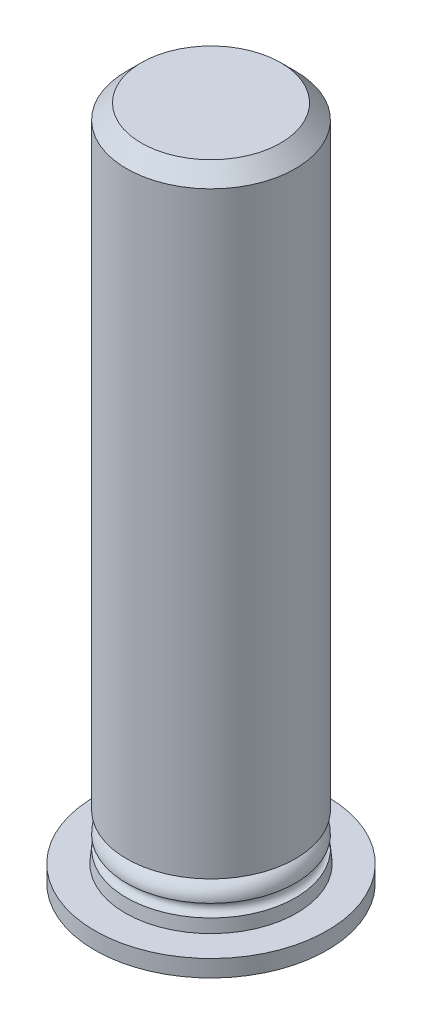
SolidWorks part; units mm, degrees
ref_plane "Face" through (0, 0, 0) normal (0, 0, 1) x (1, 0, 0)
ref_plane "Dessus" through (0, 0, 0) normal (0, 1, 0) x (1, 0, 0)
ref_plane "Droite" through (0, 0, 0) normal (1, 0, 0) x (0, 0, -1)
sketch "Esquisse1" plane through (0, 0, 0) normal (0, 0, 1) x (1, 0, 0)
  line L0 (0, 0) -> (0, 16) construction
  line L1 (0, 16) -> (1.65, 16)
  line L2 (1.65, 16) -> (2, 15.65)
  line L3 (2, 15.65) -> (2, 1.5)
  line L4 (0, 0) -> (2.75, 0)
  line L5 (2.75, 0) -> (2.75, 0.4)
  line L6 (2.75, 0.4) -> (2.0289, 0.4)
  line L7 (2.0289, 0.4) -> (2, 0.7)
  line L8 (2, 1.5) -> (1.65, 1.5)
  line L9 (1.65, 1.5) -> (1.65, 1.35)
  line L10 (0, 0) -> (0, 16)
  arc A0 (2, 0.7) -> (2, 1) centre (2, 0.85) cw
  arc A1 (2, 1) -> (1.65, 1.35) centre (1.65, 1) ccw
  dimension "D1" = 2
  dimension "D2" = 2.75
  dimension "D3" = 0.4
  dimension "D4" = 0.7
  dimension "D5" = 45
  dimension "D6" = 5.5
  dimension "D7" = 1
  dimension "D8" = 0.35
  dimension "D9" = 16
  dimension "D10" = 0.5
revolve "Révolution1" add sketch "Esquisse1" angle 360 about L0
